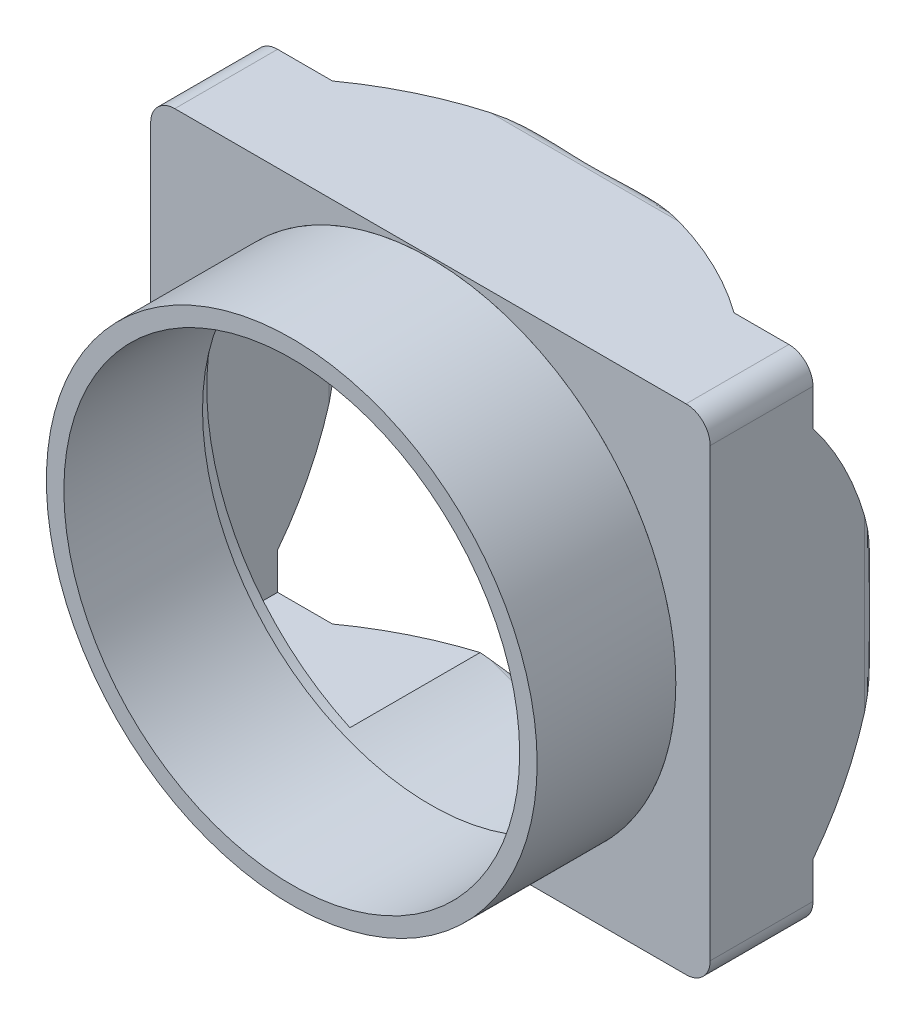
SolidWorks part; units mm, degrees
ref_plane "Front Plane" through (0, 0, 0) normal (0, 0, 1) x (1, 0, 0)
ref_plane "Top Plane" through (0, 0, 0) normal (0, 1, 0) x (1, 0, 0)
ref_plane "Right Plane" through (0, 0, 0) normal (1, 0, 0) x (0, 0, -1)
sketch "Sketch1" plane through (0, 0, 0) normal (0, 0, 1) x (1, 0, 0)
  circle A0 centre (0, 0) radius 51.689
  circle A1 centre (0, 0) radius 48.006
  dimension "D1" = 96.012
  dimension "D2" = 103.378
extrude "Extrude1" add sketch "Sketch1" against normal blind 29.21
sketch "Sketch2" plane through (0, 0, -29.21) normal (0, 0, -1) x (-1, 0, 0)
  line L1 (-58.928, 52.07) -> (58.928, 52.07)
  line L2 (-58.928, 52.07) -> (-58.928, -52.07)
  line L3 (-58.928, -52.07) -> (58.928, -52.07)
  line L4 (58.928, 52.07) -> (58.928, -52.07)
  circle A0 centre (0, 0) radius 44.45
  circle A1 centre (0, 0) radius 44.45
  dimension "D1" = 117.856
  dimension "D2" = 104.14
  dimension "D3" = 52.07
  dimension "D4" = 58.928
extrude "Extrude2" add sketch "Sketch2" along normal blind 35.052 contours L4 L1 L2 L3 M1
sketch "Sketch3" plane through (0, 0, -64.262) normal (0, 0, -1) x (-1, 0, 0)
  line L0 (-58.928, 52.07) -> (-58.928, -52.07) construction
  line L1 (-53.848, 46.99) -> (53.848, 46.99)
  line L2 (-53.848, 46.99) -> (-53.848, -46.99)
  line L3 (-53.848, -46.99) -> (53.848, -46.99)
  line L4 (53.848, 46.99) -> (53.848, -46.99)
  line L5 (-58.928, 52.07) -> (58.928, 52.07) construction
  line L6 (58.928, 52.07) -> (58.928, -52.07) construction
  line L7 (-58.928, -52.07) -> (58.928, -52.07) construction
  dimension "D1" = 5.08
  dimension "D2" = 5.08
  dimension "D3" = 5.08
  dimension "D4" = 5.08
extrude "Cut-Extrude2" cut sketch "Sketch3" against normal blind 30.48
fillet "Fillet1" radius 2.54 12 edges at (0, -52.07, -64.262) (58.928, 0, -64.262) (0, 52.07, -64.262) (-58.928, 0, -64.262) (-37.6908, -46.99, -64.262) (37.6908, -46.99, -64.262) (-53.848, 0, -64.262) (37.6908, 46.99, -64.262) (-37.6908, 46.99, -64.262) (53.848, 0, -64.262) (0, -51.689, -64.262) (0, 51.689, -64.262)
sketch "Sketch4" plane through (-58.928, 0, 0) normal (-1, 0, 0) x (0, 0, 1)
  line L0 (-50.8623, 39.2763) -> (-50.8623, 46.99)
  line L2 (-76.6621, 46.99) -> (-33.782, 46.99)
  line L3 (-50.8623, -46.99) -> (-50.8623, -39.2763)
  line L5 (-78.3821, -46.99) -> (-33.782, -46.99)
  line L6 (-78.3821, -46.99) -> (-76.6621, 46.99)
  line L7 (-76.6621, 46.99) -> (-77.1535, 47.4224)
  arc A0 (-50.8623, 39.2763) -> (-50.8623, -39.2763) centre (0, 0) ccw
extrude "Extrude3" cut sketch "Sketch4" against normal through all
sketch "Sketch5" plane through (0, 52.07, 0) normal (0, 1, 0) x (1, 0, 0)
  line L0 (53.848, 50.8623) -> (42.2916, 50.8623)
  line L1 (-53.848, 50.8623) -> (-53.848, 74.7751)
  line L2 (-53.848, 74.7751) -> (53.848, 73.0556)
  line L3 (53.848, 73.0556) -> (53.848, 50.8623)
  line L4 (-42.2916, 50.8623) -> (-53.848, 50.8623)
  arc A0 (42.2916, 50.8623) -> (-42.2916, 50.8623) centre (0, -7.9338) ccw
extrude "Extrude4" cut sketch "Sketch5" against normal through all contours A0 L3 L2 L1 M2 | A0 L1 L4 M2 | A0 L0 L3 M2
sketch "Sketch6" plane through (0, 0, -50.8623) normal (0, 0, -1) x (-1, 0, 0)
  line L1 (-63.7077, -43.0617) -> (-49.9437, -43.0617)
  line L2 (-63.7077, -43.0617) -> (-63.7077, -54.4661)
  line L3 (-63.7077, -54.4661) -> (-49.9437, -54.4661)
  line L4 (-49.9437, -43.0617) -> (-49.9437, -54.4661)
  line L5 (-63.7077, 57.2189) -> (-49.9437, 57.2189)
  line L6 (-63.7077, 57.2189) -> (-63.7077, 42.6684)
  line L7 (-63.7077, 42.6684) -> (-49.9437, 42.6684)
  line L8 (-49.9437, 57.2189) -> (-49.9437, 42.6684)
  line L9 (51.91, 57.2189) -> (60.7583, 57.2189)
  line L10 (51.91, 57.2189) -> (51.91, 42.6684)
  line L11 (51.91, 42.6684) -> (60.7583, 42.6684)
  line L12 (60.7583, 57.2189) -> (60.7583, 42.6684)
  line L13 (48.9605, -43.0617) -> (63.3144, -43.0617)
  line L14 (48.9605, -43.0617) -> (48.9605, -56.2358)
  line L15 (48.9605, -56.2358) -> (63.3144, -56.2358)
  line L16 (63.3144, -43.0617) -> (63.3144, -56.2358)
extrude "Extrude6" cut sketch "Sketch6" along normal through all contours L8 L5 L6 L7 M1 M4 M3 | L16 L13 L14 L15 | L4 L1 L2 L3 | L12 L9 L10 L11
fillet "Fillet2" radius 5.08 4 edges at (58.928, 52.07, -40.0362) (58.928, -52.07, -40.0362) (-58.928, -52.07, -40.0362) (-58.928, 52.07, -40.0362)
